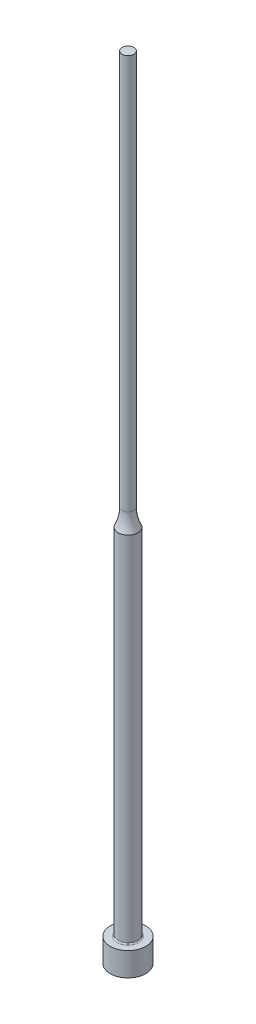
SolidWorks part; units mm, degrees
ref_plane "Front Plane" through (0, 0, 0) normal (0, 0, 1) x (1, 0, 0)
ref_plane "Top Plane" through (0, 0, 0) normal (0, 1, 0) x (1, 0, 0)
ref_plane "Right Plane" through (0, 0, 0) normal (1, 0, 0) x (0, 0, -1)
sketch "Sketch1" plane through (0, 0, 0) normal (0, 0, 1) x (1, 0, 0)
  line L0 (0, 0) -> (4.5, 0)
  line L1 (55, 0) -> (-55, 0) construction
  line L2 (4.5, 0) -> (4.5, 6)
  line L3 (4.5, 6) -> (2.8, 6)
  line L4 (2.5, 6.3) -> (2.5, 95.6411)
  line L6 (1.5, 100) -> (1.5, 200)
  line L7 (1.5, 200) -> (0, 200)
  line L8 (0, 200) -> (0, 0)
  arc A0 (1.5, 100) -> (2.5, 95.6411) centre (11.5, 100) ccw
  arc A1 (2.8, 6) -> (2.5, 6.3) centre (2.8, 6.3) cw
  dimension "D7" = 100
  dimension "D8" = 0.3
  dimension "D5" = 10
  dimension "D1" = 1.5
  dimension "D2" = 2.5
  dimension "D3" = 4.5
  dimension "D4" = 6
  dimension "D6" = 200
revolve "Revolve1" add sketch "Sketch1" angle 360 about L8
